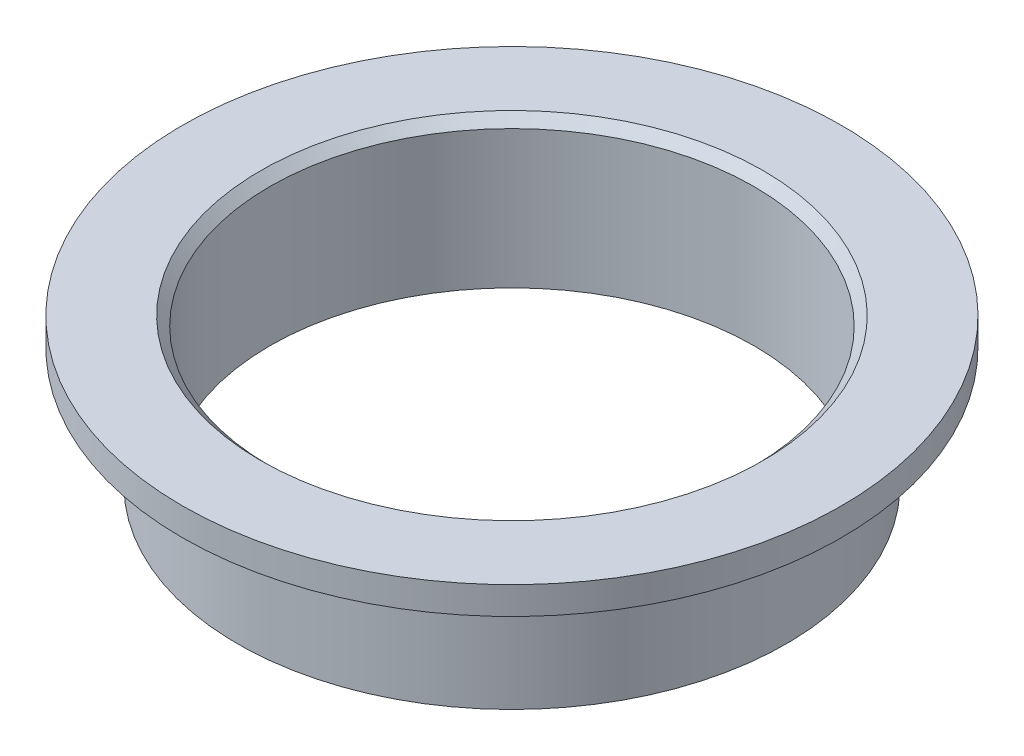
SolidWorks part; units mm, degrees
ref_plane "Front" through (0, 0, 0) normal (0, 0, 1) x (1, 0, 0)
ref_plane "Top" through (0, 0, 0) normal (0, 1, 0) x (1, 0, 0)
ref_plane "Right" through (0, 0, 0) normal (1, 0, 0) x (0, 0, -1)
sketch "Sketch1" plane through (0, 0, 0) normal (0, 1, 0) x (1, 0, 0)
  circle A0 centre (0, 0) radius 6.58
  circle A1 centre (0, 0) radius 7.46
  dimension "D1" = 14.92
  dimension "D2" = 13.16
extrude "Boss-Extrude1" add sketch "Sketch1" along normal blind 3.25
sketch "Sketch2" plane through (0, 3.25, 0) normal (0, 1, 0) x (1, 0, 0)
  circle A0 centre (0, 0) radius 6.58 construction
  circle A1 centre (0, 0) radius 6.58
  circle A4 centre (0, 0) radius 8.96
  circle A5 centre (0, 0) radius 8.96
  dimension "D1" = 1.5
extrude "Boss-Extrude2" add sketch "Sketch2" along normal blind 0.75
chamfer "Chamfer1" distance 0.25 angle 45 1 edges at (0, 4, 6.58)
